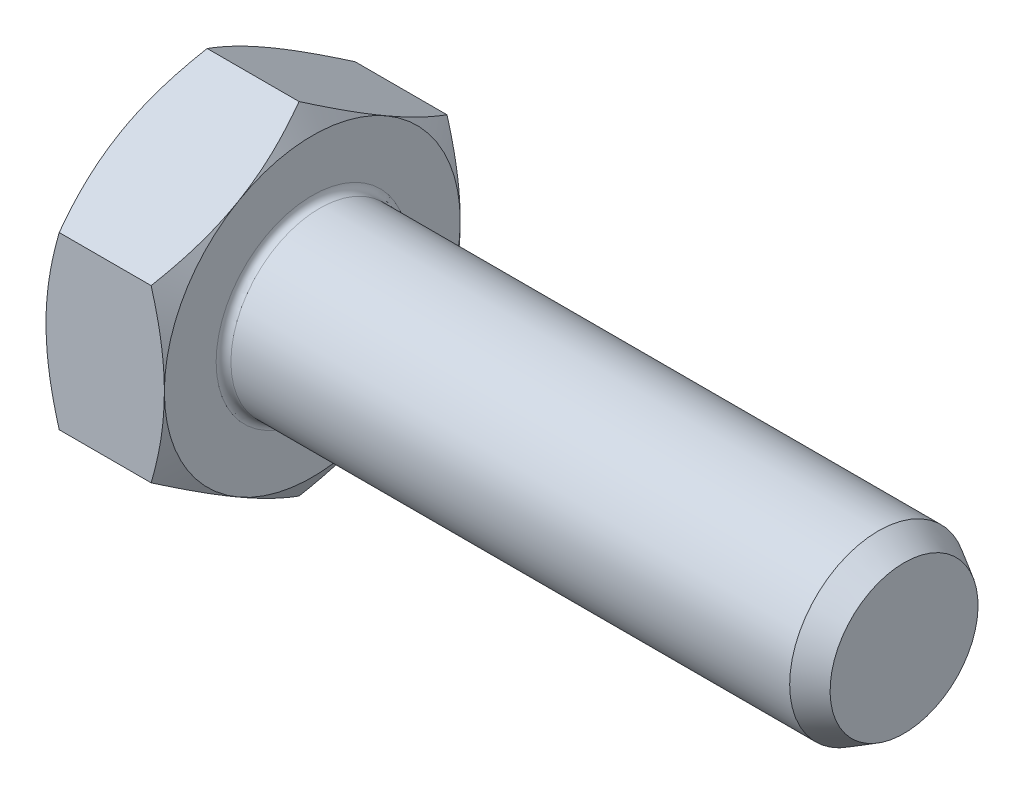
SolidWorks part; units mm, degrees
ref_plane "Front" through (0, 0, 0) normal (0, 0, 1) x (1, 0, 0)
ref_plane "Top" through (0, 0, 0) normal (0, 1, 0) x (1, 0, 0)
ref_plane "Right" through (0, 0, 0) normal (1, 0, 0) x (0, 0, -1)
sketch "Sketch2" plane through (0, 0, 0) normal (1, 0, 0) x (0, 0, -1)
  line L1 (0, 5.7735) -> (-5, 2.8868)
  line L2 (-5, 2.8868) -> (-5, -2.8868)
  line L3 (-5, -2.8868) -> (0, -5.7735)
  line L4 (0, -5.7735) -> (5, -2.8868)
  line L5 (5, -2.8868) -> (5, 2.8868)
  line L6 (5, 2.8868) -> (0, 5.7735)
  circle A0 centre (0, 0) radius 5 construction
  dimension "s" = 10
extrude "BaseHead" add sketch "Sketch2" along normal blind 4
sketch "Sketch1" plane through (0, 0, 0) normal (0, 0, 1) x (1, 0, 0)
  line L0 (-14.1054, 0) -> (35.3165, 0) construction
  line L1 (24, 0) -> (24, 3)
  line L2 (24, 3) -> (4, 3)
  line L3 (4, 3) -> (4, 0)
  line L4 (24, 0) -> (4, 0)
  line L5 (4, 2.8868) -> (4, -2.8868) construction
  dimension "d" = 6
  dimension "l" = 20
revolve "BaseBody" add sketch "Sketch1" angle 360 about L0
fillet "Fillet2" radius 0.25 1 edges at (4, 0, 3)
sketch "Sketch3" plane through (0, 0, 0) normal (0, 0, 1) x (1, 0, 0)
  line L0 (4.4119, 0) -> (11.0765, 0) construction
  line L2 (2, 5.7735) -> (2, -5.7735) construction
  line L5 (0, 5.7735) -> (0.4466, 5.7735)
  line L6 (0.4466, 5.7735) -> (0, 5)
  line L8 (0, 5) -> (0, 5.7735)
  line L9 (4, 5) -> (4, 5.7735)
  line L10 (3.5534, 5.7735) -> (4, 5)
  line L11 (4, 5.7735) -> (3.5534, 5.7735)
  dimension "D1" = 10
  dimension "D2" = 30
revolve "Cut-Revolve3" cut sketch "Sketch3" angle 360 about L0
sketch "Sketch4" plane through (0, 0, 0) normal (0, 0, 1) x (1, 0, 0)
  line L0 (25.3282, 0) -> (10.3612, 0) construction
  line L2 (23.134, -3) -> (24, -2.5)
  line L4 (24, -3) -> (24, 3) construction
  line L6 (24, -2.5) -> (24, -3)
  line L7 (24, -3) -> (23.134, -3)
  dimension "D1" = 30
  dimension "D2" = 5
  dimension "D3" = 6
revolve "Cut-Revolve1" cut sketch "Sketch4" angle 360 about L0
sketch "Sketch6" plane through (0, 0, 0) normal (0, 0, 1) x (1, 0, 0)
  line L0 (0, 0) -> (2.935, 0) construction
  line L1 (0, 0) -> (0.8, 0)
  line L2 (0, 0) -> (0, 4.1667)
  line L3 (0, 4.1667) -> (0.8, 4.1667)
  line L4 (0.8, 0) -> (0.8, 4.1667)
  dimension "D1" = 0.8
  dimension "D2" = 8.3333
revolve "Cut-Revolve4" cut sketch "Sketch6" angle 360 about L0
sketch "Sketch7" plane through (0, 0, 0) normal (0, 0, 1) x (1, 0, 0)
  line L0 (0, 0) -> (24.3746, 0) construction
  line L1 (22.8453, 3.5774) -> (23.4226, 3.5774)
  line L2 (23.4226, 3.5774) -> (23.4226, 3)
  line L3 (23.4226, 3) -> (23.134, 2.5)
  line L4 (23.134, 2.5) -> (22.8453, 3)
  line L5 (22.8453, 3) -> (22.8453, 3.5774)
  line L6 (23.134, 3) -> (23.134, -3) construction
  dimension "D1" = 6
  dimension "D2" = 2.5
revolve "Cut-Revolve10" [suppressed] cut sketch "Sketch7" angle 360 about L0
pattern_linear "LPattern10" [suppressed] count 26 spacing 0.75 along (1, 0, 0)
sketch "Sketch5" plane through (0, 0, 0) normal (0, 1, 0) x (1, 0, 0)
  line L0 (18.0155, 0) -> (2.4696, 0) construction
  line L1 (4, -2.5) -> (4, 2.5) construction
  line L2 (4, 2.5) -> (12.8873, 2.5)
  line L3 (12.8873, 2.5) -> (14.1774, 3)
  line L4 (24, -2.5) -> (24, 2.5) construction
  line L5 (14.1774, 3) -> (4, 3)
  line L6 (4, 3) -> (4, 2.5)
  dimension "D1" = 2.5
  dimension "D2" = 6
  dimension "D3" = 20
  dimension "b" = 9.8226
  dimension "x" = 1.2901
revolve "Cut-Revolve2" [suppressed] cut sketch "Sketch5" angle 360 about L0
fillet "Fillet3" [suppressed] radius 0.25
equation "\"D2@ThreadCosmetic1\" = \"d@Sketch1\" - 1"
equation "\"D2@Sketch4\" = \"D2@ThreadCosmetic1\""
equation "\"D3@Sketch4\" = \"d@Sketch1\""
equation "\"D2@Sketch5\" = \"d@Sketch1\""
equation "\"D3@Sketch5\" = \"l@Sketch1\""
equation "\"D1@Sketch3\" = \"s@Sketch2\""
equation "\"D1@Sketch5\" = \"D2@Sketch5\" / 2 - 0.5"
equation "\"D1@Sketch6\" = \"k@BaseHead\" / 5"
equation "\"D2@Sketch6\" = \"s@Sketch2\" * 5 / 6"
equation "\"D1@Sketch7\" = \"d@Sketch1\""
equation "\"D2@Sketch7\" = \"D2@Sketch5\" / 2 - 0.5"
equation "\"D3@LPattern10\" = (  \"D1@Sketch7\" / 2 - \"D2@Sketch7\" )  * 1.5"
equation "\"D1@LPattern10\" = (  \"l@Sketch1\" - (  \"D3@Sketch4\" - \"D2@Sketch4\" )  / 2 * 1.732 )  / \"D3@LPattern10\""
